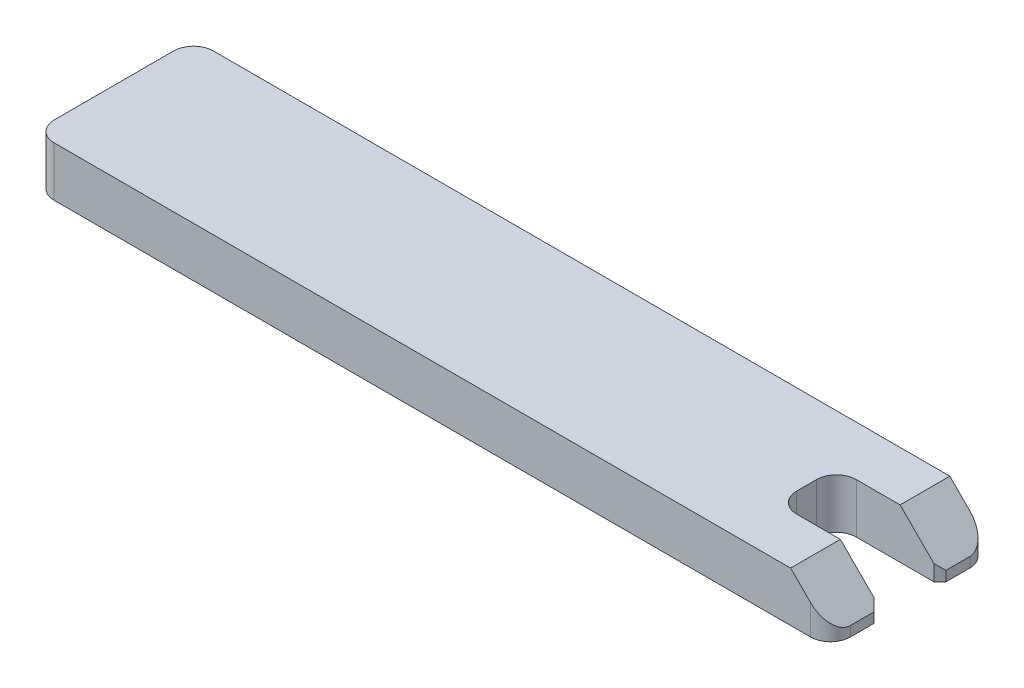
SolidWorks part; units mm, degrees
ref_plane "X_Y" through (0, 0, 0) normal (0, 0, 1) x (1, 0, 0)
ref_plane "Z_X" through (0, 0, 0) normal (0, 1, 0) x (1, 0, 0)
ref_plane "Y_Z" through (0, 0, 0) normal (1, 0, 0) x (0, 0, -1)
sketch "Sketch1" plane through (0, 0, 0) normal (0, 1, 0) x (1, 0, 0)
  line L0 (-2.6, 1.5) -> (2.6, 1.5)
  line L1 (2.6, 1.5) -> (2.6, 4)
  line L2 (2.6, 4) -> (-37.4, 4)
  line L3 (-37.4, 4) -> (-37.4, -4)
  line L4 (-2.6, 1.5) -> (-2.6, -1.5)
  line L5 (-55, 0) -> (55, 0) construction
  line L6 (2.6, -1.5) -> (2.6, -4)
  line L7 (-2.6, -1.5) -> (2.6, -1.5)
  line L8 (2.6, -4) -> (-37.4, -4)
  circle A0 centre (0, 0) radius 2.6 construction
  point P14 (0, 0)
  point P15 (0, 0)
  dimension "D1" = 3
  dimension "D2" = 5.2
  dimension "D3" = 8
  dimension "D4" = 40
extrude "Boss-Extrude1" add sketch "Sketch1" along normal mid plane 2.5
chamfer "Chamfer2" distance 2 angle 45 2 edges at (2.6, 1.25, -2.75) (2.6, 1.25, 2.75)
fillet "Fillet1" radius 1 6 edges at (-2.6, 0, 1.5) (-2.6, 0, -1.5) (2.6, -1, -4) (2.6, -1, 4) (-37.4, 0, -4) (-37.4, 0, 4)
chamfer "Chamfer1" distance 0.3 angle 45 2 edges at (2.6, -1, -1.5) (2.6, -1, 1.5)
